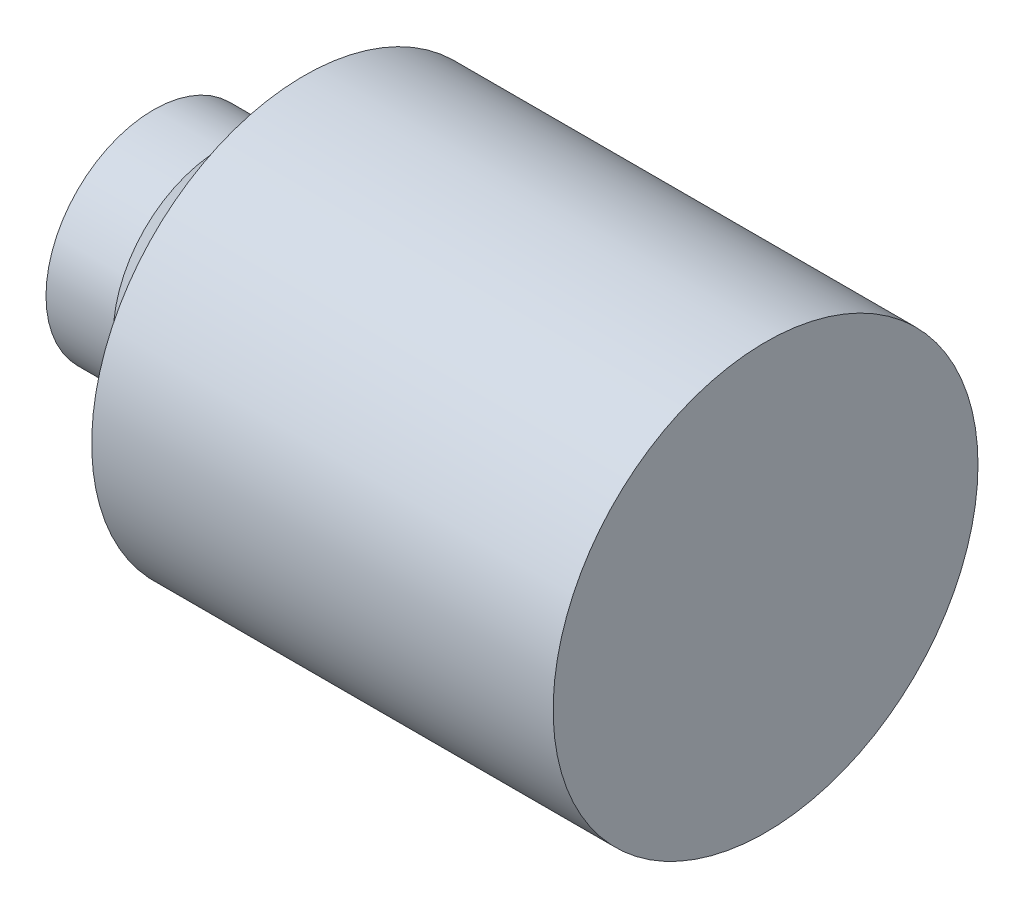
SolidWorks part; units mm, degrees
ref_plane "Front" through (0, 0, 0) normal (0, 0, 1) x (1, 0, 0)
ref_plane "Top" through (0, 0, 0) normal (0, 1, 0) x (1, 0, 0)
ref_plane "Right" through (0, 0, 0) normal (1, 0, 0) x (0, 0, -1)
sketch "Sketch2" plane through (0, 0, 0) normal (0, 0, 1) x (1, 0, 0)
  line L1 (52.8239, 12.0396) -> (52.8239, 0)
  line L3 (52.8239, 12.0396) -> (26.67, 12.0396)
  line L5 (26.67, 10.8204) -> (26.67, 12.0396)
  line L7 (26.67, 10.8204) -> (21.9456, 6.096)
  line L9 (21.9456, 6.096) -> (18.1356, 6.096)
  line L11 (50.2415, 0) -> (50.2415, 11)
  line L13 (50.2415, 11) -> (34.2415, 11)
  line L15 (34.2415, 11) -> (34.2415, 5.5178)
  line L17 (34.2415, 5.5178) -> (26.2415, 5.5178)
  line L19 (26.2415, 5.5178) -> (26.2415, 3.9688)
  line L20 (0, 0) -> (-7.6074, 0) construction
  line L22 (50.2415, 0) -> (52.8239, 0)
  line L23 (18.1356, 6.096) -> (18.1356, 3.9688)
  line L24 (18.1356, 3.9688) -> (26.2415, 3.9688)
  dimension "D1" = 3.9688
  dimension "D2" = 5.5178
  dimension "D3" = 11
  dimension "D4" = 18.1356
  dimension "D5" = 6.096
  dimension "D6" = 26.67
  dimension "D7" = 34.2415
  dimension "D8" = 50.2415
  dimension "D9" = 52.8239
  dimension "D10" = 12.0396
  dimension "D11" = 45
  dimension "D12" = 3.81
  dimension "D13" = 26.2415
revolve "Revolve2" add sketch "Sketch2" angle 360 about L20
